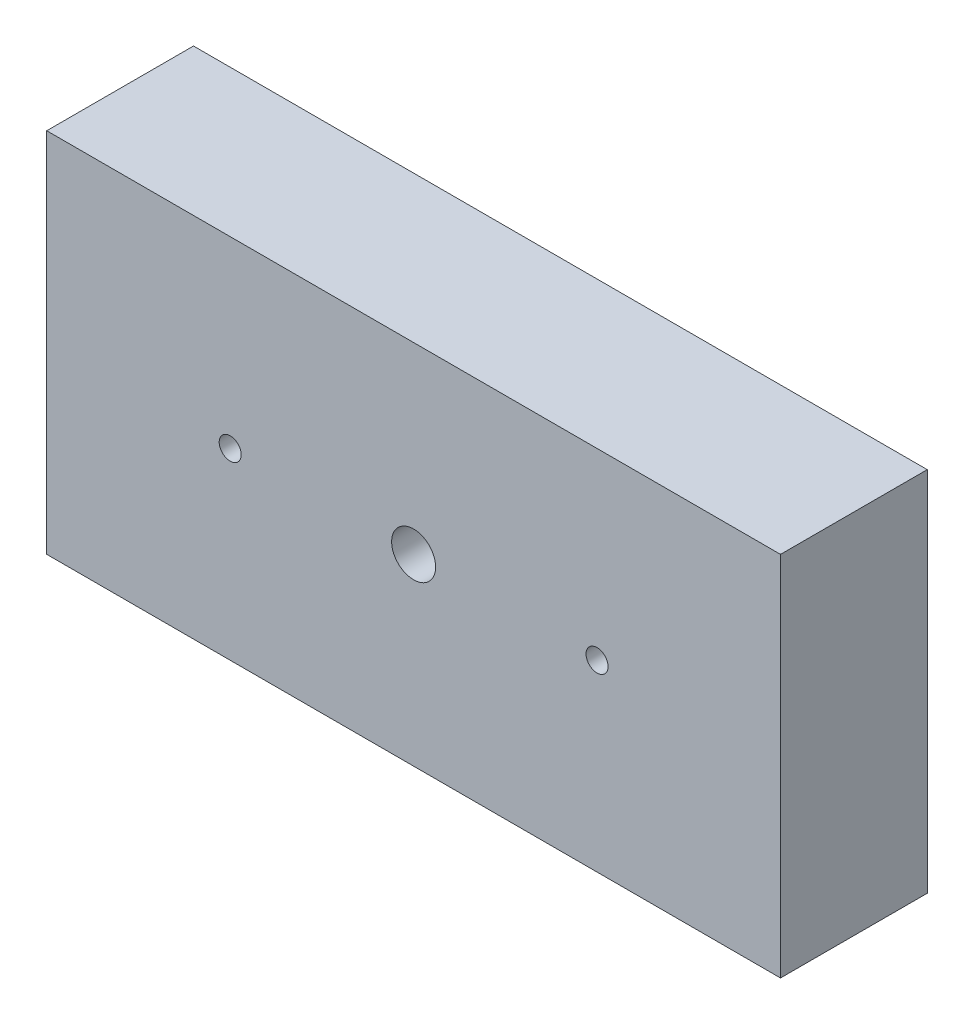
SolidWorks part; units mm, degrees
ref_plane "Plan de face" through (0, 0, 0) normal (0, 0, 1) x (1, 0, 0)
ref_plane "Plan de dessus" through (0, 0, 0) normal (0, 1, 0) x (1, 0, 0)
ref_plane "Plan de droite" through (0, 0, 0) normal (1, 0, 0) x (0, 0, -1)
sketch "Esquisse1" plane through (0, 0, 0) normal (0, 0, 1) x (1, 0, 0)
  line L1 (0, 0) -> (50, 0)
  line L2 (0, 0) -> (0, 25)
  line L3 (0, 25) -> (50, 25)
  line L4 (50, 0) -> (50, 25)
  circle A0 centre (12.5, 12.5) radius 0.75
  circle A1 centre (37.5, 12.5) radius 0.75
  dimension "D3" = 1.5
  dimension "D6" = 1.5
  dimension "D1" = 25
  dimension "D2" = 50
  dimension "D4" = 12.5
  dimension "D5" = 12.5
  dimension "D7" = 12.5
extrude "Boss.-Extru.1" add sketch "Esquisse1" along normal blind 10
sketch "Esquisse2" plane through (0, 0, 10) normal (0, 0, 1) x (1, 0, 0)
  line L0 (50, 0) -> (50, 25) construction
  line L1 (50, 25) -> (0, 25) construction
  circle A0 centre (25, 12.5) radius 1.5
  dimension "D1" = 3
  dimension "D2" = 25
  dimension "D3" = 12.5
extrude "Enlèv. mat.-Extru.1" cut sketch "Esquisse2" against normal blind 10
